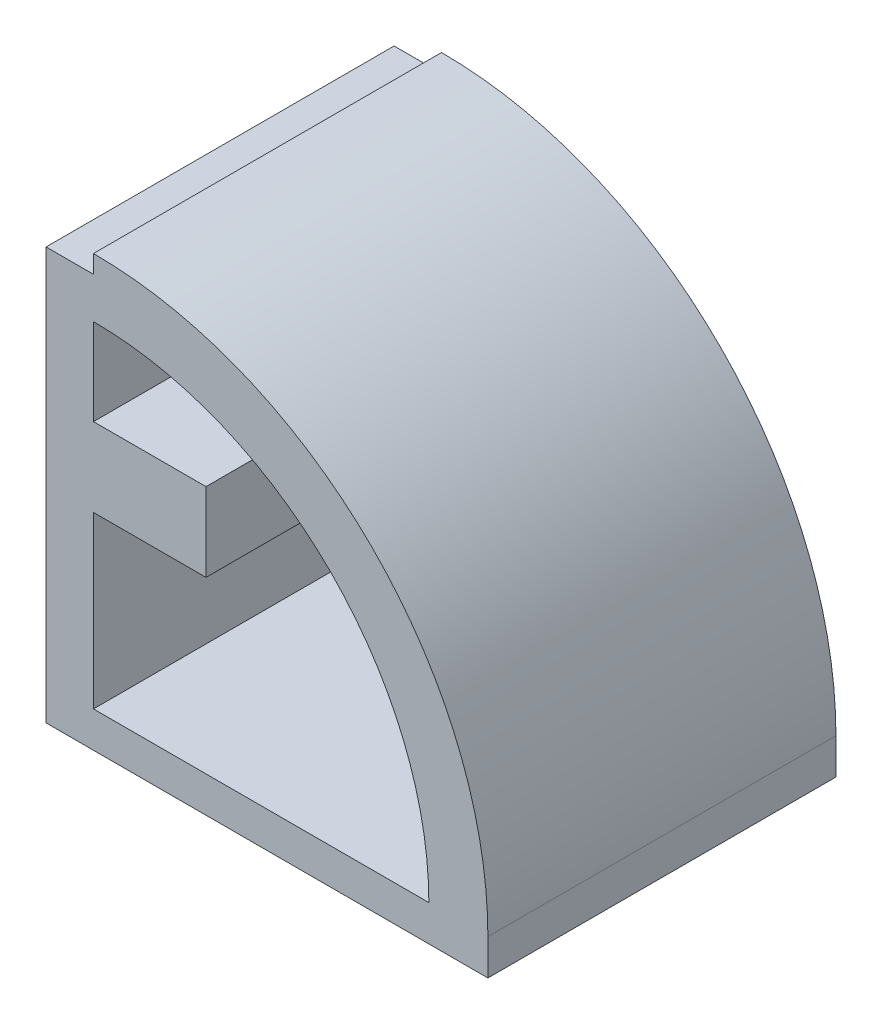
SolidWorks part; units mm, degrees
ref_plane "Front Plane" through (0, 0, 0) normal (0, 0, 1) x (1, 0, 0)
ref_plane "Top Plane" through (0, 0, 0) normal (0, 1, 0) x (1, 0, 0)
ref_plane "Right Plane" through (0, 0, 0) normal (1, 0, 0) x (0, 0, -1)
sketch "Sketch1" plane through (0, 0, 0) normal (0, 0, 1) x (1, 0, 0)
  line L0 (0, 157.5143) -> (0, 0)
  line L1 (0, 0) -> (168.8397, 0)
  line L2 (168.8397, 0) -> (168.8397, 13.6845)
  line L3 (168.8397, 13.6845) -> (18.1175, 13.6845)
  line L4 (18.1175, 13.6845) -> (18.1175, 157.5143)
  line L5 (18.1175, 157.5143) -> (0, 157.5143)
extrude "Boss-Extrude1" add sketch "Sketch1" along normal mid plane 133
sketch "Sketch3" plane through (18.1175, 0, 0) normal (1, 0, 0) x (0, 0, -1)
  line L0 (-66.5, 13.6845) -> (-66.5, 157.5143) construction
  line L1 (-66.5, 108.7619) -> (66.5, 108.7619)
  line L2 (-66.5, 108.7619) -> (-66.5, 78.7189)
  line L3 (-66.5, 78.7189) -> (66.5, 78.7189)
  line L4 (66.5, 108.7619) -> (66.5, 78.7189)
  line L5 (66.5, 13.6845) -> (66.5, 157.5143) construction
extrude "Boss-Extrude2" add sketch "Sketch3" along normal blind 43
sketch "Sketch2" plane through (0, 13.6845, 0) normal (0, 1, 0) x (-1, 0, 0)
  line L0 (-168.8397, -66.5) -> (-18.1175, -66.5) construction
  line L3 (-168.8397, 66.5) -> (-146.2794, 66.5)
  line L4 (-168.8397, 66.5) -> (-168.8397, -66.5)
  line L5 (-168.8397, -66.5) -> (-146.2794, -66.5)
  line L6 (-146.2794, 66.5) -> (-146.2794, -66.5)
revolve "Revolve1" add sketch "Sketch2" about axis through (18.1175, 13.6845, 66.5) along (0, 0, -1)
